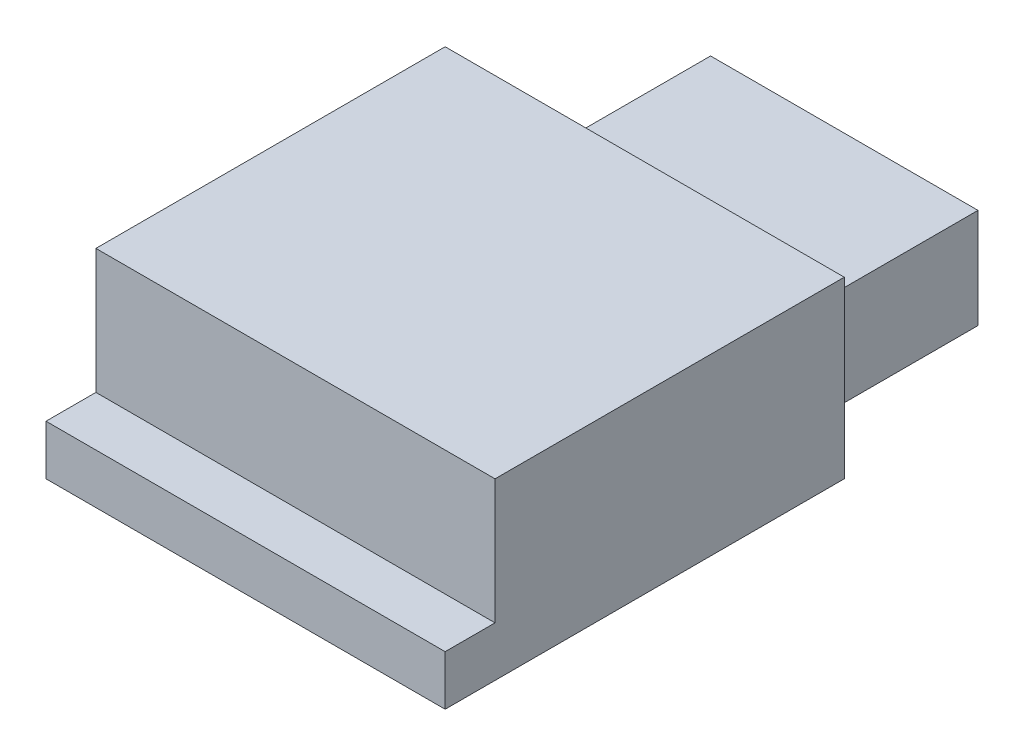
SolidWorks part; units mm, degrees
ref_plane "Front Plane" through (0, 0, 0) normal (0, 0, 1) x (1, 0, 0)
ref_plane "Top Plane" through (0, 0, 0) normal (0, 1, 0) x (1, 0, 0)
ref_plane "Right Plane" through (0, 0, 0) normal (1, 0, 0) x (0, 0, -1)
sketch "Sketch1" plane through (0, 0, 0) normal (0, 1, 0) x (1, 0, 0)
  line L1 (0, 0) -> (10.16, 0)
  line L2 (0, 0) -> (0, 10.16)
  line L3 (0, 10.16) -> (10.16, 10.16)
  line L4 (10.16, 0) -> (10.16, 10.16)
  dimension "D1" = 10.16
  dimension "D2" = 10.16
extrude "Extrude1" add sketch "Sketch1" along normal blind 1.27
sketch "Sketch3" plane through (0, 1.27, 0) normal (0, 1, 0) x (-1, 0, 0)
  line L0 (0, -10.16) -> (0, 0) construction
  line L1 (-10.16, -10.16) -> (0, -10.16)
  line L2 (-10.16, -10.16) -> (-10.16, -1.27)
  line L3 (-10.16, -1.27) -> (0, -1.27)
  line L4 (0, -10.16) -> (0, -1.27)
  line L5 (0, 0) -> (-10.16, 0) construction
  dimension "D1" = 1.27
extrude "Extrude2" add sketch "Sketch3" along normal blind 3.175
sketch "Sketch4" plane through (0, 0, -10.16) normal (0, 0, -1) x (-1, 0, 0)
  line L0 (-5.08, 4.445) -> (-5.08, 0) construction
  line L1 (-10.16, 4.445) -> (0, 4.445) construction
  line L2 (-10.16, 0) -> (0, 0) construction
  line L4 (-8.4836, 0) -> (-1.6764, 0)
  line L5 (-8.4836, 0) -> (-8.4836, 2.54)
  line L6 (-8.4836, 2.54) -> (-1.6764, 2.54)
  line L7 (-1.6764, 0) -> (-1.6764, 2.54)
  dimension "D1" = 6.8072
  dimension "D2" = 3.4036
  dimension "D3" = 2.54
extrude "Extrude3" add sketch "Sketch4" along normal blind 5.08
